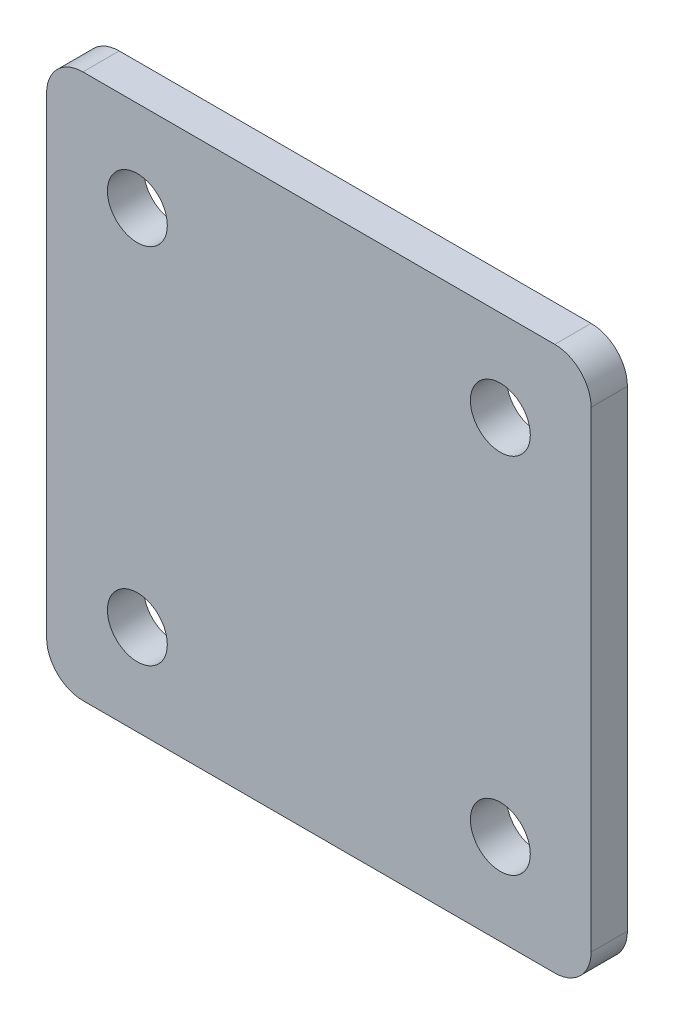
SolidWorks part; units mm, degrees
ref_plane "前视基准面" through (0, 0, 0) normal (0, 0, 1) x (1, 0, 0)
ref_plane "上视基准面" through (0, 0, 0) normal (0, 1, 0) x (1, 0, 0)
ref_plane "右视基准面" through (0, 0, 0) normal (1, 0, 0) x (0, 0, -1)
other "Configuration Table"
sketch "草图1" plane through (0, 0, 0) normal (0, 0, 1) x (1, 0, 0)
  line L1 (-15, 15) -> (15, 15)
  line L2 (-15, 15) -> (-15, -15)
  line L3 (-15, -15) -> (15, -15)
  line L4 (15, 15) -> (15, -15)
  line L5 (-15, 15) -> (15, -15) construction
  line L6 (-15, -15) -> (15, 15) construction
  point P0 (0, 0)
  dimension "D1" = 30
  dimension "D2" = 30
extrude "凸台-拉伸1" add sketch "草图1" along normal blind 2
hole_wizard "M4 螺纹孔1" positions "草图2" profile "草图3" tap size "M4" standard "GB"
sketch "草图2" plane through (0, 0, 2) normal (0, 0, 1) x (1, 0, 0)
  line L0 (-15, 15) -> (-15, -15) construction
  line L1 (15, 15) -> (-15, 15) construction
  line L2 (15, -15) -> (15, 15) construction
  line L3 (-15, -15) -> (15, -15) construction
  point P0 (-10, 10)
  point P2 (10, 10)
  point P4 (-10, -10)
  point P6 (10, -10)
  dimension "D1" = 5
  dimension "D2" = 5
  dimension "D3" = 5
  dimension "D4" = 5
  dimension "D5" = 5
  dimension "D6" = 5
  dimension "D7" = 5
  dimension "D8" = 5
sketch "草图3" plane through (-10, 10, 2) normal (1, 0, 0) x (0, -1, 0)
  line L0 (0, 0) -> (0, 2)
  line L1 (0, 2) -> (1.65, 2)
  line L2 (1.65, 2) -> (1.65, 0)
  line L5 (1.65, 0) -> (0, 0)
  line L11 (0, -6.35) -> (0, 107.95) construction
  dimension "通孔螺纹孔钻头直径" = 3.3
  dimension "通孔螺纹孔钻头深度" = 2
fillet "圆角1" radius 2 4 edges at (-15, -15, 1) (15, -15, 1) (15, 15, 1) (-15, 15, 1)
